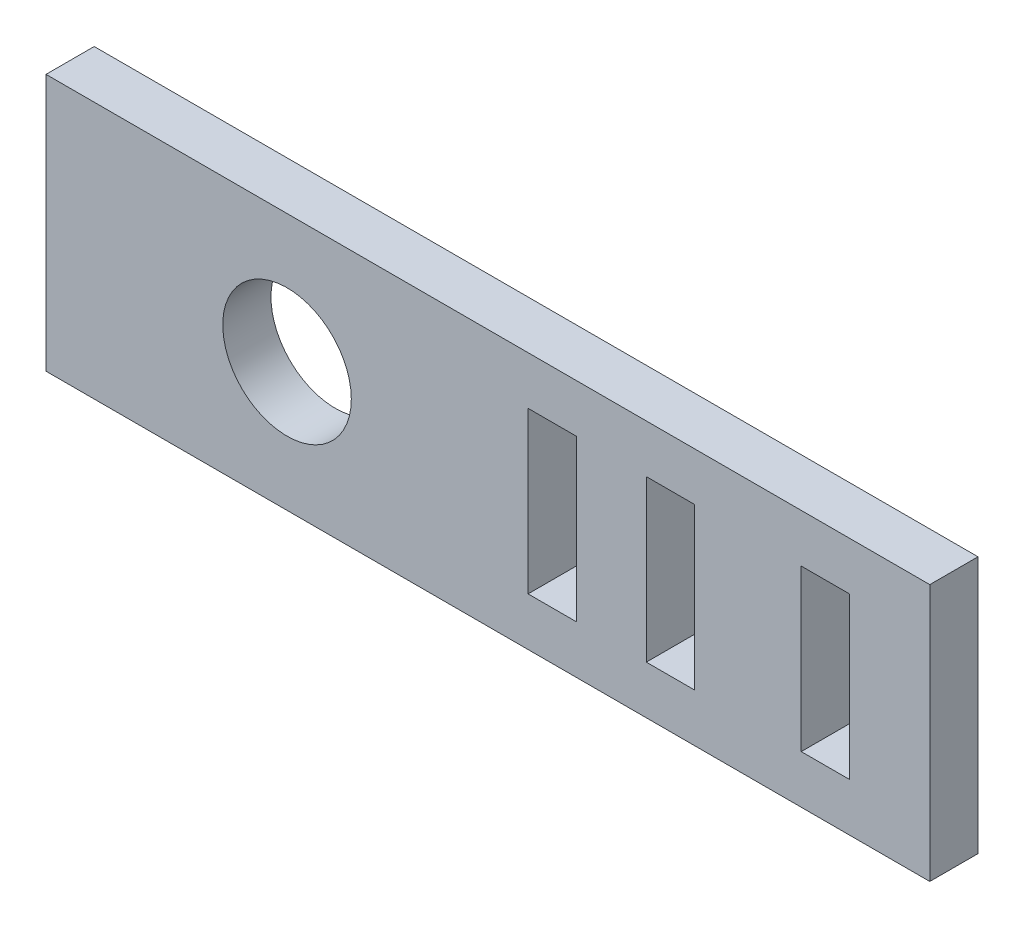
SolidWorks part; units mm, degrees
ref_plane "Plan de face" through (0, 0, 0) normal (0, 0, 1) x (1, 0, 0)
ref_plane "Plan de dessus" through (0, 0, 0) normal (0, 1, 0) x (1, 0, 0)
ref_plane "Plan de droite" through (0, 0, 0) normal (1, 0, 0) x (0, 0, -1)
sketch "Esquisse1" plane through (0, 0, 0) normal (0, 0, 1) x (1, 0, 0)
  line L0 (0, 0) -> (-15, 0) construction
  line L1 (-15, -8) -> (40, -8)
  line L2 (-15, -8) -> (-15, 8)
  line L3 (-15, 8) -> (40, 8)
  line L4 (40, -8) -> (40, 8)
  circle A0 centre (0, 0) radius 4
  dimension "D1" = 8
  dimension "D2" = 15
  dimension "D3" = 55
  dimension "D4" = 16
extrude "Boss.-Extru.1" add sketch "Esquisse1" along normal blind 3
other "Empreinte1"
other "temoin<1>@coulisseau1"
other "Empreinte2"
other "butee coulisseau<1>@coulisseau1"
other "butee coulisseau<2>@coulisseau1"
